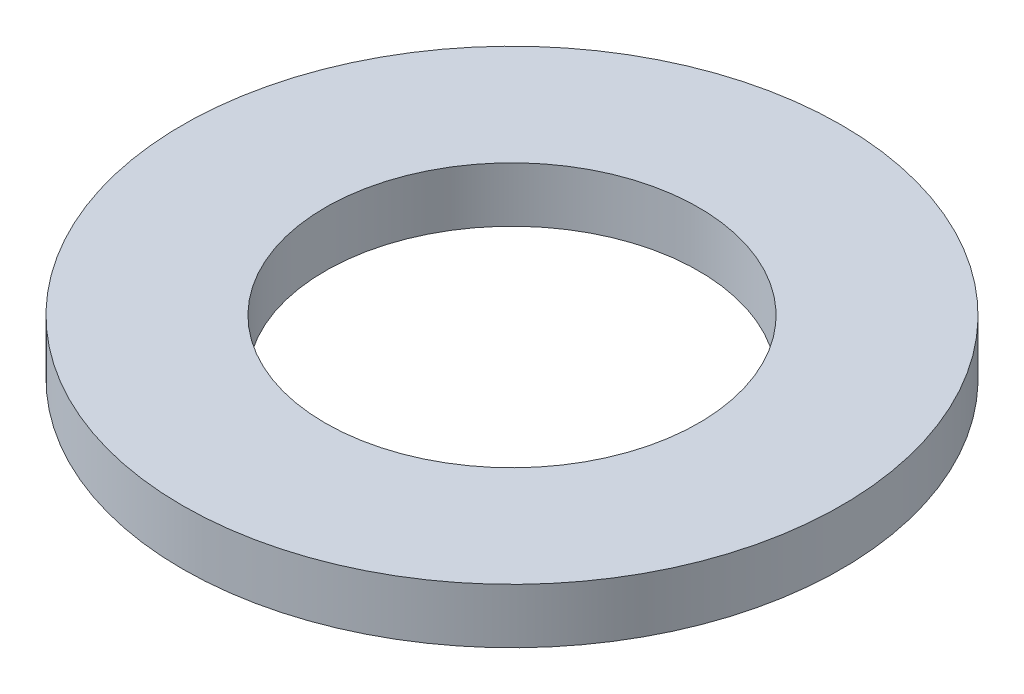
SolidWorks part; units mm, degrees
ref_plane "Front" through (0, 0, 0) normal (0, 0, 1) x (1, 0, 0)
ref_plane "Top" through (0, 0, 0) normal (0, 1, 0) x (1, 0, 0)
ref_plane "Right" through (0, 0, 0) normal (1, 0, 0) x (0, 0, -1)
sketch "Sketch1" plane through (0, 0, 0) normal (0, 1, 0) x (1, 0, 0)
  circle A0 centre (0, 0) radius 17
  circle A1 centre (0, 0) radius 30
extrude "Extrude1" add sketch "Sketch1" along normal blind 5
